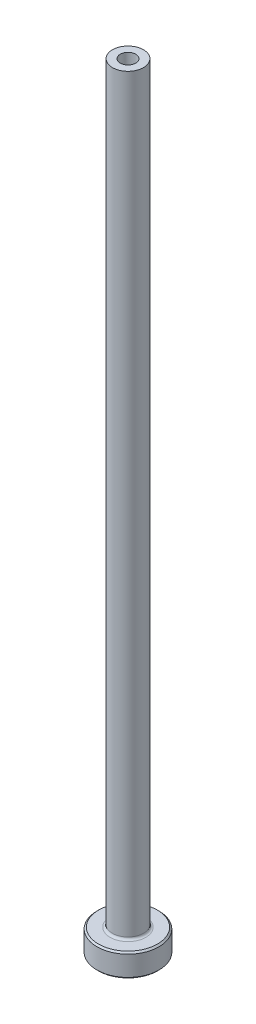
SolidWorks part; units mm, degrees
ref_plane "Front Plane" through (0, 0, 0) normal (0, 0, 1) x (1, 0, 0)
ref_plane "Top Plane" through (0, 0, 0) normal (0, 1, 0) x (1, 0, 0)
ref_plane "Right Plane" through (0, 0, 0) normal (1, 0, 0) x (0, 0, -1)
sketch "Sketch1" plane through (0, 0, 0) normal (0, 0, 1) x (1, 0, 0)
  line L0 (-1, 100) -> (-2, 100)
  line L1 (-2, 100) -> (-2, 3)
  line L2 (-2, 3) -> (-4, 3)
  line L3 (-4, 3) -> (-4, 0)
  line L4 (5.5, 0) -> (-5.5, 0) construction
  line L5 (-4, 0) -> (-1.25, 0)
  line L6 (-1, 65) -> (-1, 100)
  line L7 (0, 92.1877) -> (0, -15.5353) construction
  line L8 (0, -5.5) -> (0, 5.5) construction
  line L9 (-1, 65) -> (-1.25, 53)
  line L10 (-1.25, 53) -> (-1.25, 0)
  dimension "D1" = 0.25
  dimension "ID" = 2
  dimension "OD" = 4
  dimension "L" = 100
  dimension "H" = 8
  dimension "T" = 3
  dimension "N" = 35
  dimension "D2" = 12
revolve "Revolve1" add sketch "Sketch1" angle 360 about L7
fillet "Fillet1" radius 0.3 1 edges at (0, 3, 2)
chamfer "Chamfer1" distance 0.2 angle 45 2 edges at (0, 3, 4) (0, 0, 4)
chamfer "Chamfer3" distance 0.5 angle 45 1 edges at (0, 0, 1.25)
